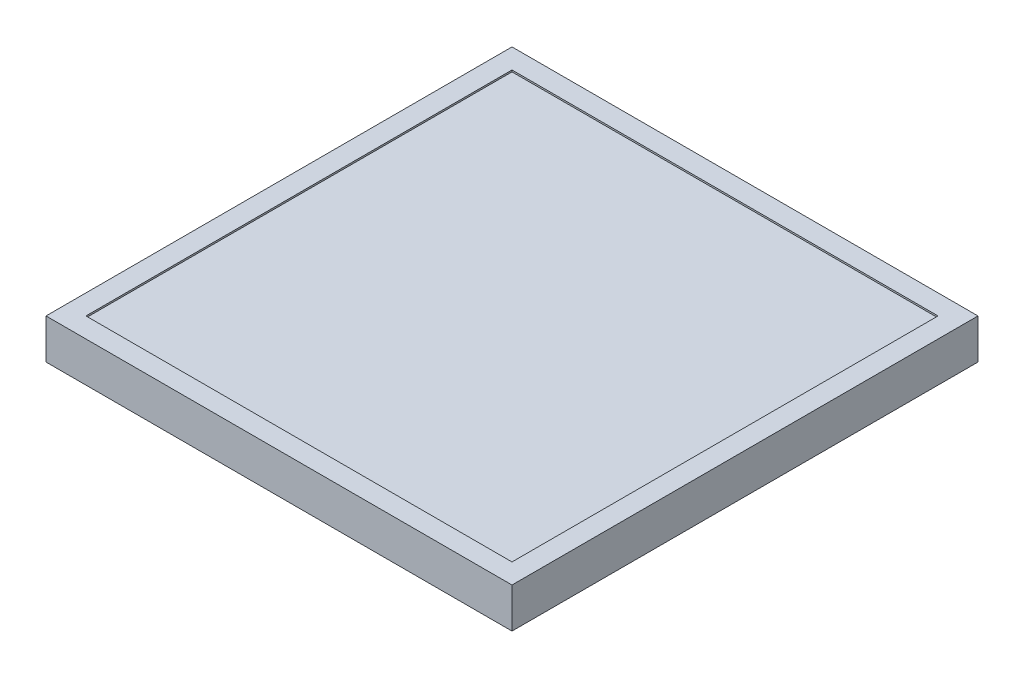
SolidWorks part; units mm, degrees
ref_plane "Alzado" through (0, 0, 0) normal (0, 0, 1) x (1, 0, 0)
ref_plane "Planta" through (0, 0, 0) normal (0, 1, 0) x (1, 0, 0)
ref_plane "Vista lateral" through (0, 0, 0) normal (1, 0, 0) x (0, 0, -1)
sketch "Croquis1" plane through (0, 0, 0) normal (0, 1, 0) x (1, 0, 0)
  line L1 (-135.8565, -145.2549) -> (144.1435, -145.2549)
  line L2 (-135.8565, -145.2549) -> (-135.8565, 134.7451)
  line L3 (-135.8565, 134.7451) -> (144.1435, 134.7451)
  line L4 (144.1435, -145.2549) -> (144.1435, 134.7451)
  line L5 (-135.8565, -145.2549) -> (144.1435, 134.7451) construction
  line L6 (-135.8565, 134.7451) -> (144.1435, -145.2549) construction
  dimension "D1" = 280
  dimension "D2" = 280
extrude "Saliente-Extruir1" add sketch "Croquis1" along normal blind 24
sketch "Croquis3" plane through (0, 24, 0) normal (0, 1, 0) x (1, 0, 0)
  line L0 (144.1435, -145.2549) -> (144.1435, 134.7451) construction
  line L1 (-123.8565, -133.2549) -> (132.1435, -133.2549)
  line L2 (-123.8565, -133.2549) -> (-123.8565, 122.7451)
  line L3 (-123.8565, 122.7451) -> (132.1435, 122.7451)
  line L4 (132.1435, -133.2549) -> (132.1435, 122.7451)
  line L5 (-123.8565, -133.2549) -> (132.1435, 122.7451) construction
  line L6 (-123.8565, 122.7451) -> (132.1435, -133.2549) construction
  line L7 (144.1435, 134.7451) -> (-135.8565, 134.7451) construction
  line L8 (-135.8565, 134.7451) -> (-135.8565, -145.2549) construction
  line L9 (-135.8565, -145.2549) -> (144.1435, -145.2549) construction
  point P0 (4.1435, -5.2549)
  dimension "D1" = 12
  dimension "D2" = 12
  dimension "D3" = 12
  dimension "D4" = 12
extrude "Cortar-Extruir2" cut sketch "Croquis3" against normal blind 1
